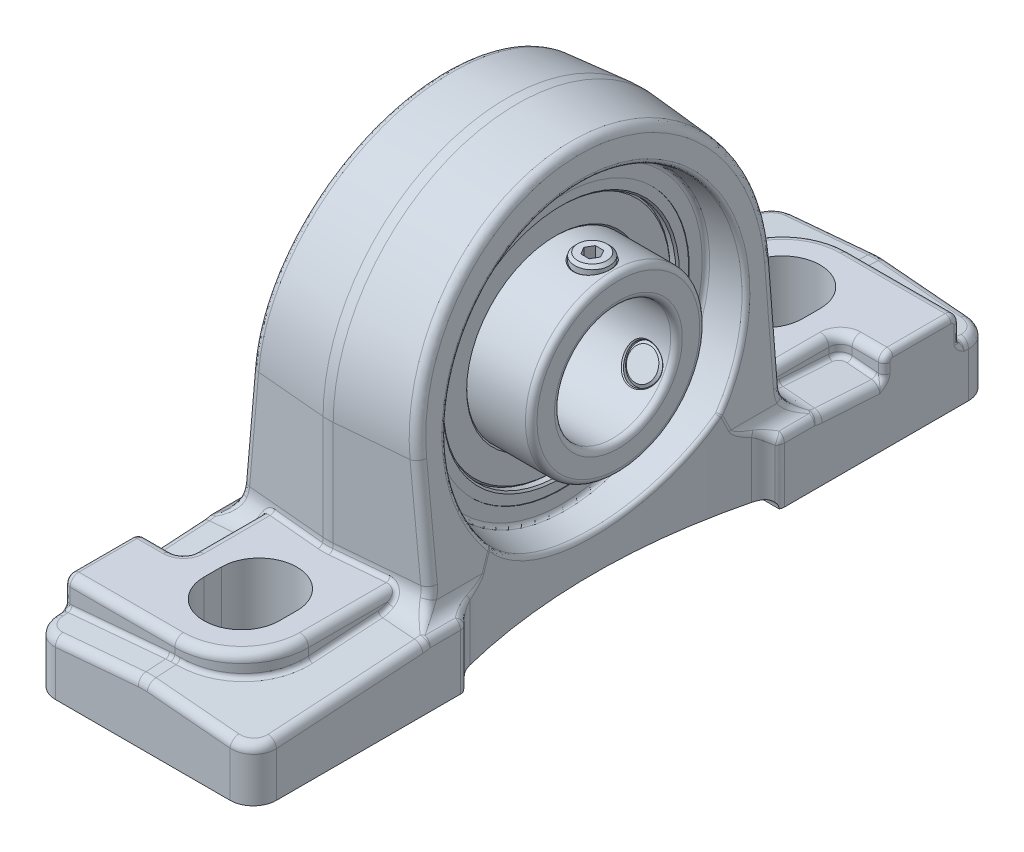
SolidWorks part; units mm, degrees
ref_plane "Plan de face" through (0, 0, 0) normal (0, 0, 1) x (1, 0, 0)
ref_plane "Plan de dessus" through (0, 0, 0) normal (0, 1, 0) x (1, 0, 0)
ref_plane "Plan de droite" through (0, 0, 0) normal (1, 0, 0) x (0, 0, -1)
sketch "Esquisse1" plane through (0, 0, 0) normal (0, 0, 1) x (1, 0, 0)
  line L1 (8.5, 20.3) -> (8.2, 20)
  line L2 (-8.5, 21.9089) -> (-8.5, 20.3)
  line L3 (-8.2, 20) -> (-3.1225, 20)
  line L5 (-11.7, 15) -> (-3.1225, 15)
  line L6 (-12.7, 14) -> (-12.7, 11)
  line L7 (-11.7, 10) -> (17.3, 10)
  line L8 (18.3, 14) -> (18.3, 11)
  line L11 (-8.5, 20.3) -> (-8.2, 20)
  line L12 (3.1225, 20) -> (8.2, 20)
  line L13 (3.1225, 15) -> (17.3, 15)
  line L14 (0, 0) -> (30.4647, 0) construction
  line L21 (8.5, 21.9089) -> (8.5, 20.3)
  arc A0 (8.5, 21.9089) -> (-8.5, 21.9089) centre (0, 0) ccw
  arc A1 (-12.7, 11) -> (-11.7, 10) centre (-11.7, 11) ccw
  arc A2 (-12.7, 14) -> (-11.7, 15) centre (-11.7, 14) cw
  arc A3 (17.3, 10) -> (18.3, 11) centre (17.3, 11) ccw
  arc A4 (-3.1225, 15) -> (3.1225, 15) centre (0, 17.5) ccw
  arc A5 (3.1225, 20) -> (-3.1225, 20) centre (0, 17.5) ccw
  arc A6 (18.3, 14) -> (17.3, 15) centre (17.3, 14) ccw
  point P2 (-8.5, 20)
  point P14 (8.5, 20)
  point P18 (18.3, 10)
  dimension "D5" = 4
  dimension "D13" = 8.5
  dimension "D3" = 23.5
  dimension "D16" = 8.5
  dimension "D22" = 1
  dimension "D23" = 1
  dimension "D8" = 1
  dimension "D1" = 10
  dimension "D2" = 5
  dimension "D4" = 18.3
  dimension "D9" = 17
  dimension "D6" = 12.7
  dimension "D7" = 5
  dimension "D12" = 7.5
  dimension "D15" = 12.7
revolve "Révolution1" add sketch "Esquisse1" angle 360 about L14
sketch "Esquisse2" plane through (0, 0, 0) normal (0, 0, 1) x (1, 0, 0)
  line L0 (3.1225, 15) -> (17.3, 15) construction
  line L1 (7.2, 20) -> (6, 20)
  line L2 (7.5, 19.7) -> (7.5, 15.3)
  line L3 (7.2, 15) -> (6, 15)
  line L4 (6, 20) -> (6, 15)
  line L6 (-7.2, 20) -> (-6, 20)
  line L7 (-7.5, 19.7) -> (-7.5, 15.3)
  line L8 (-7.2, 15) -> (-6, 15)
  line L9 (-6, 20) -> (-6, 15)
  line L10 (-7.5, 19.7) -> (-7.2, 20)
  line L11 (-7.5, 15.3) -> (-7.2, 15)
  line L12 (7.5, 15.3) -> (7.2, 15)
  line L13 (7.5, 19.7) -> (7.2, 20)
  line L14 (3.1225, 20) -> (8.2, 20) construction
  line L16 (-11.7, 15) -> (-3.1225, 15) construction
  line L18 (8.5, 21.9089) -> (8.5, 20.3) construction
  line L19 (-8.5, 21.9089) -> (-8.5, -21.9089) construction
  line L20 (-8.2, 20) -> (-3.1225, 20) construction
  point P0 (7.5, 20)
  point P2 (7.5, 15)
  point P7 (-7.5, 20)
  point P9 (-7.5, 15)
  dimension "D1" = 1.5
  dimension "D2" = 1
  dimension "D3" = 1
revolve "Révolution2" add sketch "Esquisse2" angle 360 about L14
sketch "Esquisse3" plane through (0, 0, 0) normal (0, 0, 1) x (1, 0, 0)
  line L0 (0, 21.5) -> (0, 13.5)
  arc A0 (0, 13.5) -> (0, 21.5) centre (0, 17.5) ccw
revolve "Révolution3" add sketch "Esquisse3" angle 360 about L0
pattern_circular "Répétition circulaire1" count 10 over 360 about axis through (0, 0, 0) along (1, 0, 0)
sketch "Esquisse19" plane through (0, 0, 0) normal (0, 1, 0) x (1, 0, 0)
  line L0 (-11.7, 0) -> (17.3, 0) construction
  line L2 (18.3, -14) -> (18.3, 14) construction
  circle A0 centre (13.8, 0) radius 3
  dimension "D1" = 6
  dimension "D2" = 4.5
extrude "Enlèv. mat.-Extru.6" cut sketch "Esquisse19" along normal blind 30
sketch "Esquisse20" plane through (0, 0, 0) normal (0, 0, 1) x (1, 0, 0)
  line L0 (13.8, 15) -> (13.8, 10) construction
  line L1 (-11.7, 15) -> (-3.1225, 15) construction
  line L2 (13.8, 10) -> (11.3, 10)
  line L3 (11.3, 10) -> (10.8, 10.5)
  line L4 (10.8, 10.5) -> (10.8, 15.5)
  line L5 (10.8, 15.5) -> (11.3, 16)
  line L6 (11.3, 16) -> (13.8, 16)
  line L7 (13.8, 16) -> (13.8, 10)
  line L8 (-12.7, 14) -> (-12.7, 11) construction
  dimension "D1" = 26.5
  dimension "D2" = 3
  dimension "D3" = 5
  dimension "D4" = 6
  dimension "D5" = 0.5
  dimension "D6" = 0.5
  dimension "D7" = 0.5
revolve "Révolution7" add sketch "Esquisse20" angle 360 about L0
sketch "Esquisse21" plane through (0, 16, 0) normal (0, 1, 0) x (1, 0, 0)
  line L1 (12.3566, 0.0005) -> (13.0778, -1.2497)
  line L2 (13.0778, -1.2497) -> (14.5212, -1.2503)
  line L3 (14.5212, -1.2503) -> (15.2434, -0.0005)
  line L4 (15.2434, -0.0005) -> (14.5222, 1.2497)
  line L5 (14.5222, 1.2497) -> (13.0788, 1.2503)
  line L6 (13.0788, 1.2503) -> (12.3566, 0.0005)
  circle A0 centre (13.8, 0) radius 1.25 construction
  dimension "D1" = 2.5
extrude "Enlèv. mat.-Extru.7" cut sketch "Esquisse21" against normal blind 3
chamfer "Chanfrein3" distance 0.2 angle 45 2 edges at (13.2553, 9.5549, 2.9501) (14.4236, 14.7102, 2.9345)
pattern_circular "Répétition circulaire3" count 2 every 120 about axis through (0, 0, 0) along (-1, 0, 0) of "Chanfrein3", "Enlèv. mat.-Extru.6"
pattern_circular "Répétition circulaire2" count 2 every 120 about axis through (0, 0, 0) along (1, 0, 0)
combine bodies "Combiner1" operation type add bodies to combine 136 137 135
sketch "Esquisse22" plane through (0, 0, 0) normal (1, 0, 0) x (0, 0, -1)
  line L0 (31.7, 0) -> (31.7, -17.9828)
  line L1 (63.5, -33.3) -> (-63.5, -33.3)
  line L2 (-31.7, -17.9828) -> (-31.7, 0)
  line L3 (0, 0) -> (0, 31.7) construction
  line L4 (63.5, -33.3) -> (63.5, -22.8)
  line L5 (63.5, -22.8) -> (34.5117, -20.9768)
  line L6 (-63.5, -33.3) -> (-63.5, -22.8)
  line L7 (-63.5, -22.8) -> (-34.5117, -20.9768)
  arc A0 (31.7, 0) -> (-31.7, 0) centre (0, 0) ccw
  arc A1 (-34.5117, -20.9768) -> (-31.7, -17.9828) centre (-34.7, -17.9828) ccw
  arc A2 (34.5117, -20.9768) -> (31.7, -17.9828) centre (34.7, -17.9828) cw
  point P13 (-31.7, -20.8)
  point P16 (31.7, -20.8)
  dimension "D4" = 127
  dimension "D6" = 3
  dimension "D1" = 33.3
  dimension "D2" = 65
  dimension "D3" = 10.5
  dimension "D5" = 12.5
extrude "Boss.-Extru.1" add sketch "Esquisse22" along normal blind 19 separate body
chamfer "Chanfrein4" distance 19 angle 5 7 edges at (19, -8.9914, -31.7) (19, 31.7, 0) (19, -8.9914, 31.7) (19, -21.8884, -49.0058) (19, -20.0364, -32.5131) (19, -21.8884, 49.0058) (19, -20.0364, 32.5131)
sketch "Esquisse23" plane through (0, 0, 0) normal (0, 0, 1) x (1, 0, 0)
  line L0 (0, 0) -> (30.9053, 0) construction
  line L1 (8.6, 21.9089) -> (8.6, 24.1215)
  line L3 (0, 23.5) -> (0, 0)
  line L4 (0, 0) -> (23.0663, 0)
  line L5 (23.0663, 0) -> (23.0663, 4.4941)
  line L6 (21.5231, 26.9876) -> (21.5231, 26.3589)
  line L7 (21.5231, 26.3589) -> (23.0663, 26.3589)
  line L8 (23.0663, 26.3589) -> (23.0663, 4.4941)
  line L9 (8.5, 21.9089) -> (8.6, 21.9089)
  line L10 (9.1784, 24.8109) -> (21.5231, 26.9876)
  arc A0 (8.5, 21.9089) -> (0, 23.5) centre (0, 0) ccw
  arc A1 (8.5, 21.9089) -> (-8.5, 21.9089) centre (0, 0) ccw construction
  arc A2 (8.6, 24.1215) -> (9.1784, 24.8109) centre (9.3, 24.1215) cw
  point P19 (8.6, 24.7089)
  dimension "D3" = 0.7
  dimension "D1" = 0.1
  dimension "D2" = 2.8
  dimension "D4" = 100
revolve "Enlèvement de matière-Révolution1" cut sketch "Esquisse23" angle 360 about L0
sketch "Esquisse24" plane through (0, 0, 63.5) normal (0, 0, 1) x (1, 0, 0)
  line L0 (0, -20.9768) -> (19, -22.6358) construction
  line L1 (0, -20.9768) -> (19, -22.6358) construction
  line L2 (16.2742, -19.9289) -> (11.5, 30.6939)
  line L3 (11.5, 30.6939) -> (19, 30.6939)
  line L4 (19, 30.6939) -> (19, -22.6358)
  line L6 (19, 30.0377) -> (0, 31.7) construction
  line L7 (0, 31.7) -> (0, 0) construction
  arc A0 (19, -22.6358) -> (16.2742, -19.9289) centre (19.261, -19.6472) cw
  dimension "D1" = 3
  dimension "D2" = 11.5
extrude "Enlèv. mat.-Extru.8" cut sketch "Esquisse24" against normal blind 100
sketch "Esquisse25" plane through (0, -33.3, 0) normal (0, -1, 0) x (1, 0, 0)
  line L0 (0, 63.5) -> (0, -63.5) construction
  line L1 (21.8263, 28) -> (104.6064, 28)
  line L2 (14, 18) -> (14, -18) construction
  line L3 (21.8263, -28) -> (104.6064, -28)
  line L4 (104.6064, 28) -> (104.6064, -28)
  line L5 (0, 0) -> (30.4647, 0) construction
  line L6 (160.2305, 169.3331) -> (160.2305, -174.5655) construction
  arc A0 (14, -18) -> (24, -28) centre (24, -18) ccw construction
  arc A1 (24, 28) -> (14, 18) centre (24, 18) ccw construction
  arc A2 (16.975, 24.2105) -> (16.975, -24.2105) centre (114, 0) ccw
  arc A3 (21.8263, 28) -> (16.975, 24.2105) centre (21.8263, 23) ccw
  arc A4 (21.8263, -28) -> (16.975, -24.2105) centre (21.8263, -23) cw
  dimension "D1" = 10
  dimension "D5" = 200
  dimension "D6" = 5
  dimension "D7" = 5
  dimension "D2" = 14
  dimension "D3" = 28
  dimension "D4" = 56
extrude "Enlèv. mat.-Extru.9" cut sketch "Esquisse25" against normal blind 50
sketch "Esquisse27" plane through (19, 0, 0) normal (1, 0, 0) x (0, 0, -1)
  line L1 (-25.6246, -31.8) -> (25.6246, -31.8)
  line L2 (-27.1246, -33.3) -> (-27.1246, -43.3853)
  line L3 (-27.1246, -43.3853) -> (25.6246, -43.3853)
  line L4 (27.1246, -33.3) -> (27.1246, -41.8853)
  line L6 (27.1246, -33.3) -> (27.1246, -22.6358) construction
  line L7 (27.1246, -33.3) -> (63.5, -33.3) construction
  arc A0 (27.1246, -41.8853) -> (25.6246, -43.3853) centre (25.6246, -41.8853) cw
  arc A1 (-25.6246, -31.8) -> (-27.1246, -33.3) centre (-25.6246, -33.3) ccw
  arc A2 (25.6246, -31.8) -> (27.1246, -33.3) centre (25.6246, -33.3) cw
  dimension "D1" = 1.5
  dimension "D2" = 1.5
extrude "Enlèv. mat.-Extru.10" cut sketch "Esquisse27" against normal blind 50
fillet "Congé1" radius 1.5 9 edges at (18.3986, -22.5206, -33.8895) (16.1848, -18.9807, -30.3983) (15.2427, -8.9914, -30.3664) (11.5, 30.6939, 0) (18.4568, -22.5374, 33.9578) (16.1848, -18.9807, 30.3983) (15.2427, -8.9914, 30.3664) (19, -27.9679, 27.1246) (19, -27.9679, -27.1246)
fillet "Congé4" radius 4 2 edges at (19, -28.8828, -63.5) (19, -28.8828, 63.5)
mirror "Symétrie1" about plane through (0, 0, 0) normal (1, 0, 0)
fillet "Congé5" radius 10 7 edges at (0, -8.9914, -31.7) (0, -8.9914, 31.7) (0, 31.7, 0) (0, -21.8884, -49.0058) (0, -20.0364, -32.5131) (0, -21.8884, 49.0058) (0, -20.0364, 32.5131)
fillet "Congé6" radius 1.5 38 edges at (19, -23.4257, -46.9664) (17.8284, -24.2892, -62.3284) (7.9358, -23.4957, -63.5) (0, -22.8383, -63.5) (-7.9358, -23.4957, -63.5) (-17.8284, -24.2892, -62.3284) (-19, -22.6358, -31.1074) (-19, -23.4257, 46.9664) (-17.8284, -24.2892, 62.3284) (-7.9358, -23.4957, 63.5) (0, -22.8383, 63.5) (7.9358, -23.4957, 63.5) (17.8284, -24.2892, 62.3284) (19, -22.6358, -31.1074) (-19, -23.4257, -46.9664) (-19, -22.6358, 31.1074) (19, -22.6358, 31.1074) (19, -23.4257, 46.9664) (16.1264, -18.3615, 20.5124) (16.1264, -18.3615, -20.5124) (16.3261, -20.2691, -21.4433) (17.5173, -22.0885, -25.5363) (18.8026, -22.612, -27.1074) (-16.1264, -18.3615, 20.5124) (-16.1264, -18.3615, -20.5124) (-16.3597, -20.4105, 21.5956) (-17.9049, -22.3232, 26.1021) (-18.9171, -22.6274, 27.3593) (16.3597, -20.4105, 21.5956) (17.9049, -22.3232, 26.1021) (18.9171, -22.6274, 27.3593) (-16.3261, -20.2691, -21.4433) (-18.8026, -22.612, -27.1074) (-17.5173, -22.0885, -25.5363)
sketch "Esquisse28" plane through (0, -33.3, 0) normal (0, -1, 0) x (1, 0, 0)
  line L0 (0, 46.5) -> (0, 43.5) construction
  line L1 (6.5, 46.5) -> (6.5, 43.5)
  line L2 (-6.5, 46.5) -> (-6.5, 43.5)
  line L3 (8.5, 0) -> (-8.5, 0) construction
  line L4 (-11.5, 43) -> (-11.5, 27.1246)
  line L5 (-18.8123, 27.1246) -> (18.8123, 27.1246) construction
  line L6 (-11.5, 27.1246) -> (11.5, 27.1246)
  line L7 (11.5, 27.1246) -> (11.5, 46.5)
  line L8 (0, 58) -> (-19, 58)
  line L9 (-19, 59.5) -> (-19, 27.8511) construction
  line L10 (-19, 58) -> (-19, 45)
  line L11 (-19, 45) -> (-13.5, 45)
  line L12 (11.5, -43) -> (11.5, -27.1246)
  line L13 (11.5, -27.1246) -> (-11.5, -27.1246)
  line L14 (-11.5, -27.1246) -> (-11.5, -46.5)
  line L15 (0, -58) -> (19, -58)
  line L16 (19, -58) -> (19, -45)
  line L17 (19, -45) -> (13.5, -45)
  line L18 (0, -46.5) -> (0, -43.5) construction
  line L19 (-6.5, -46.5) -> (-6.5, -43.5)
  line L20 (6.5, -46.5) -> (6.5, -43.5)
  arc A0 (6.5, 46.5) -> (-6.5, 46.5) centre (0, 46.5) ccw
  arc A1 (-6.5, 43.5) -> (6.5, 43.5) centre (0, 43.5) ccw
  arc A2 (11.5, 46.5) -> (0, 58) centre (0, 46.5) ccw
  arc A3 (-13.5, 45) -> (-11.5, 43) centre (-13.5, 43) cw
  arc A4 (-11.5, -46.5) -> (0, -58) centre (0, -46.5) ccw
  arc A5 (13.5, -45) -> (11.5, -43) centre (13.5, -43) cw
  arc A6 (-6.5, -46.5) -> (6.5, -46.5) centre (0, -46.5) ccw
  arc A7 (6.5, -43.5) -> (-6.5, -43.5) centre (0, -43.5) ccw
  point P3 (0, 45)
  point P29 (0, -45)
  dimension "D1" = 6.5
  dimension "D4" = 23
  dimension "D5" = 2
  dimension "D2" = 3
  dimension "D3" = 45
  dimension "D6" = 2
extrude "Boss.-Extru.2" add sketch "Esquisse28" against normal blind 14
fillet "Congé7" radius 1.5 12 edges at (-16.25, -19.3, 45) (-12.0858, -19.3, 44.4142) (11.5, -19.3, 38.7083) (-9.5, -19.3, 58) (16.25, -19.3, -45) (12.0858, -19.3, -44.4142) (-11.5, -19.3, -38.7083) (9.5, -19.3, -58) (-11.5, -19.3, 36.9583) (8.1317, -19.3, 54.6317) (11.5, -19.3, -36.9583) (-8.1317, -19.3, -54.6317)
fillet "Congé8" radius 0.75 34 edges at (-18.6059, -24.4815, 58) (-9.2511, -23.2651, 58) (-0.4362, -22.5019, 58) (-18.6059, -23.6639, 45) (-15.5654, -23.001, 45) (-12.0858, -22.6591, 44.4142) (-11.5, -22.2499, 38.7243) (-11.5, -21.6294, 33.0415) (-11.216, -19.9218, 31.2228) (2.2417, -19.3, 31.788) (11.1921, -19.8896, 31.2074) (11.5, -21.6294, 33.0415) (11.5, -22.3599, 40.4743) (18.6059, -24.4815, -58) (9.2511, -23.2651, -58) (0.4362, -22.5019, -58) (-8.4342, -22.9618, -54.3175) (-11.5, -22.3599, -40.4743) (-11.5, -21.6294, -33.0415) (-11.1921, -19.8896, -31.2074) (1.9298, -19.3, -11.8878) (11.216, -19.9218, -31.2228) (11.5, -21.6294, -33.0415) (11.5, -22.2499, -38.7243) (12.0858, -22.6591, -44.4142) (18.6059, -23.6639, -45) (8.4342, -22.9618, 54.3175) (15.5654, -23.001, -45)
sketch "Esquisse29" plane through (0, -19.3, 0) normal (0, 1, 0) x (1, 0, 0)
  line L0 (-6.5, 43.5) -> (-6.5, 46.5) construction
  line L1 (6.5, 46.5) -> (6.5, 43.5) construction
  line L2 (-6.5, -46.5) -> (-6.5, -43.5) construction
  line L3 (6.5, -43.5) -> (6.5, -46.5) construction
  line L4 (-6.5, 43.5) -> (-6.5, 46.5)
  line L5 (6.5, 46.5) -> (6.5, 43.5)
  line L6 (-6.5, -46.5) -> (-6.5, -43.5)
  line L7 (6.5, -43.5) -> (6.5, -46.5)
  arc A0 (-6.5, 43.5) -> (6.5, 43.5) centre (0, 43.5) ccw construction
  arc A1 (6.5, 46.5) -> (-6.5, 46.5) centre (0, 46.5) ccw construction
  arc A2 (-6.5, -46.5) -> (6.5, -46.5) centre (0, -46.5) ccw construction
  arc A3 (6.5, -43.5) -> (-6.5, -43.5) centre (0, -43.5) ccw construction
  arc A4 (-6.5, 43.5) -> (6.5, 43.5) centre (0, 43.5) ccw
  arc A5 (6.5, 46.5) -> (-6.5, 46.5) centre (0, 46.5) ccw
  arc A6 (-6.5, -46.5) -> (6.5, -46.5) centre (0, -46.5) ccw
  arc A7 (6.5, -43.5) -> (-6.5, -43.5) centre (0, -43.5) ccw
extrude "Enlèv. mat.-Extru.11" cut sketch "Esquisse29" against normal blind 15
fillet "Congé9" radius 1 16 edges at (-19, -21.8759, 45) (-19, -19.3, 51.5) (-19, -22.3318, 58) (-19, -19.7393, 57.5607) (-19, -19.7393, 45.4393) (19, -21.8759, -45) (19, -19.3, -51.5) (19, -22.3318, -58) (19, -19.7393, -57.5607) (19, -19.7393, -45.4393) (-18.3938, -23.4751, 58) (18.3938, -23.4751, -58) (-19, -24.384, 58.0896) (-19, -23.472, 44.9104) (19, -24.384, -58.0896) (19, -23.472, -44.9104)
fillet "Congé10" radius 0.75 8 edges at (-14.0875, -25.3337, -4.1814) (14.0875, -25.3337, -4.1814) (-12.0078, 25.3098, 0) (12.0078, 25.3098, 0)
